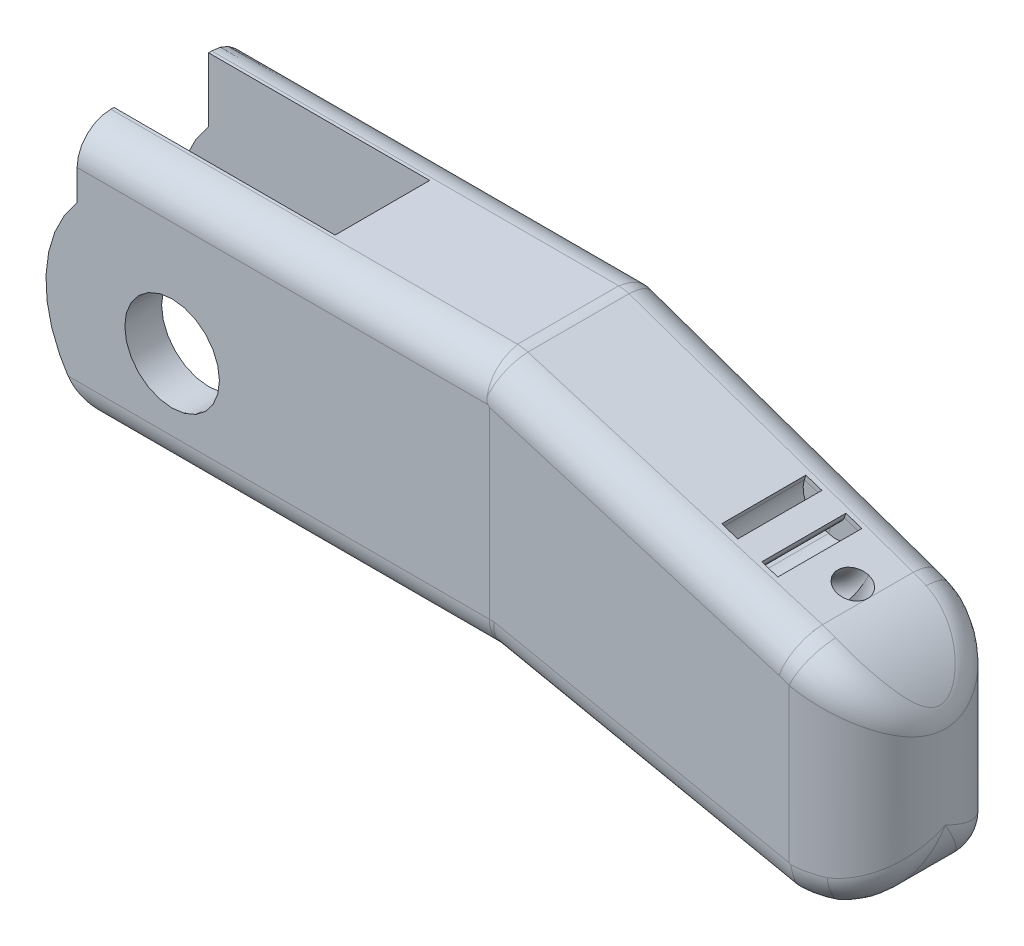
SolidWorks part; units mm, degrees
ref_plane "Front Plane" through (0, 0, 0) normal (0, 0, 1) x (1, 0, 0)
ref_plane "Top Plane" through (0, 0, 0) normal (0, 1, 0) x (1, 0, 0)
ref_plane "Right Plane" through (0, 0, 0) normal (1, 0, 0) x (0, 0, -1)
sketch "Sketch1" plane through (0, 0, 0) normal (0, 1, 0) x (1, 0, 0)
  line L0 (29.21, 12.7) -> (51.435, 12.3031)
  line L1 (0, 0) -> (29.21, 0)
  line L2 (0, 0) -> (0, 12.7)
  line L3 (0, 12.7) -> (29.21, 12.7)
  line L5 (51.435, 0.3969) -> (29.21, 0)
  arc A0 (51.435, 12.3031) -> (51.435, 0.3969) centre (51.3287, 6.35) cw
  point P9 (0, 6.35)
  dimension "D1" = 12.7
  dimension "D2" = 11.9062
  dimension "D3" = 29.21
  dimension "D4" = 22.225
extrude "Boss-Extrude1" add sketch "Sketch1" along normal blind 24.13
sketch "Sketch3" plane through (0, 0, 0) normal (0, 0, 1) x (1, 0, 0)
  line L0 (29.21, 24.13) -> (29.21, 0) construction
  line L1 (0, 0) -> (31.75, 0)
  line L2 (0, 0) -> (0, 5.08)
  line L3 (0, 5.08) -> (29.21, 5.08)
  line L5 (29.21, 5.08) -> (51.435, 0)
  line L6 (51.435, 0) -> (31.75, 0)
  dimension "D1" = 19.05
extrude "Cut-Extrude1" cut sketch "Sketch3" against normal through all
sketch "Sketch4" plane through (0, 0, 0) normal (0, 0, 1) x (1, 0, 0)
  line L0 (29.21, 24.13) -> (51.435, 16.9111)
  line L1 (51.435, 24.13) -> (51.435, 0) construction
  line L2 (57.2828, 0) -> (57.2828, 24.13) construction
  line L3 (57.2828, 11.9883) -> (57.2828, 24.13)
  line L4 (57.2828, 24.13) -> (29.21, 24.13)
  arc A0 (51.435, 16.9111) -> (57.2828, 11.9883) centre (48.2963, 7.248) cw
  dimension "D2" = 10.16
  dimension "D1" = 23.368
extrude "Cut-Extrude2" cut sketch "Sketch4" against normal through all
sketch "Sketch5" plane through (0, 0, 0) normal (0, 0, 1) x (1, 0, 0)
  line L2 (52.9648, 0) -> (57.2828, 0)
  line L3 (57.2828, 0) -> (57.2828, 5.0225)
  arc A0 (57.2828, 5.0225) -> (52.9648, 0) centre (52.2028, 5.0225) cw
  dimension "D1" = 5.08
  dimension "D2" = 4.318
extrude "Cut-Extrude3" cut sketch "Sketch5" against normal through all
sketch "Sketch7" plane through (0, 0, 0) normal (0, 0, 1) x (1, 0, 0)
  line L0 (0, 20.955) -> (0, 5.08)
  line L1 (0, 20.955) -> (0, 24.13)
  line L2 (0, 24.13) -> (29.21, 24.13) construction
  line L3 (0, 24.13) -> (-1.905, 24.13)
  line L4 (-1.905, 24.13) -> (-1.905, 19.2876)
  arc A1 (-1.905, 19.2876) -> (0, 5.08) centre (5.2651, 13.0175) ccw
  dimension "D2" = 19.05
  dimension "D1" = 3.175
  dimension "D3" = 1.905
  dimension "D4" = 4.8424
ref_plane "Plane1" through (0, 0, -6.35) normal (0, 0, 1) x (1, 0, 0)
extrude "Boss-Extrude4" add sketch "Sketch7" against normal up to surface (12.7 mm away)
sketch "Sketch9" plane through (0, 24.13, 0) normal (0, 1, 0) x (1, 0, 0)
  line L0 (-10.4775, 6.35) -> (10.4775, 6.35) construction
  line L5 (-4.2599, 2.7781) -> (14.7901, 2.7781)
  line L6 (-4.2599, 2.7781) -> (-4.2599, 9.9219)
  line L7 (-4.2599, 9.9219) -> (14.7901, 9.9219)
  line L8 (14.7901, 2.7781) -> (14.7901, 9.9219)
  line L11 (-4.2599, 12.7) -> (-4.2599, 0) construction
  point P4 (14.7901, 6.35)
  dimension "D1" = 7.1437
  dimension "D2" = 19.05
extrude "Cut-Extrude5" cut sketch "Sketch9" against normal through all
fillet "Fillet1" radius 2.54 3 edges at (40.3225, 20.5205, -12.5016) (57.2358, 12.0763, -7.0964) (40.3225, 20.5205, -0.1984)
sketch "Sketch10" plane through (0, 0, 0) normal (0, 0, 1) x (1, 0, 0)
  circle A0 centre (5.2651, 13.0175) radius 3.5719
  arc A1 (-1.905, 19.2876) -> (0, 5.08) centre (5.2651, 13.0175) ccw construction
  dimension "D1" = 7.1437
extrude "Cut-Extrude6" cut sketch "Sketch10" against normal through all
sketch "Sketch11" plane through (14.7901, 0, 0) normal (-1, 0, 0) x (0, 0, 1)
  line L0 (-6.35, -10.4775) -> (-6.35, 10.4775) construction
  line L1 (-2.7781, 24.13) -> (-9.9219, 24.13) construction
  circle A0 centre (-6.35, 22.225) radius 1.1906
  dimension "D1" = 2.3813
  dimension ".075" = 1.905
sketch "Sketch12" plane through (0, 0, -6.35) normal (0, 0, 1) x (1, 0, 0)
  line L0 (29.21, 18.2486) -> (14.7901, 21.0344)
  line L1 (51.435, 16.9111) -> (53.7298, 21.5724)
  line L2 (29.21, 21.4741) -> (29.21, 5.08) construction
  line L3 (29.21, 18.2486) -> (43.1878, 13.7084)
  line L5 (50.6957, 14.4953) -> (29.21, 21.4741) construction
  arc A0 (43.1878, 13.7084) -> (51.435, 16.9111) centre (45.3492, 20.3627) ccw
  dimension "D2" = 6.9965
  dimension "D1" = 3.0677
  dimension "D3" = 4.6613
  dimension "D4" = 2.2948
sweep "Cut-Sweep1" cut profiles "Sketch11" path "Sketch12"
sketch "Sketch13" plane through (9.8773, 30.4095, 0) normal (0.3089, 0.9511, 0) x (0.9511, -0.3089, 0)
  line L0 (20.3269, 10.1736) -> (20.3269, 2.5264) construction
  line L1 (38.6149, 9.525) -> (39.8849, 9.525)
  line L2 (38.6149, 9.525) -> (38.6149, 3.175)
  line L3 (38.6149, 3.175) -> (39.8849, 3.175)
  line L4 (39.8849, 9.525) -> (39.8849, 3.175)
  line L6 (46.1107, 6.35) -> (37.9024, 6.35) construction
  line L7 (43.6949, 6.35) -> (43.6949, 2.9233) construction
  point P6 (39.8849, 6.35)
  point P12 (20.3269, 6.35)
  point P14 (43.6949, 4.6366)
  dimension "D1" = 6.35
  dimension "D2" = 1.27
  dimension "D3" = 3.81
sketch "Sketch14" plane through (0, 0, -6.35) normal (0, 0, 1) x (1, 0, 0)
  line L1 (46.6035, 18.4804) -> (46.4858, 18.118)
  line L2 (53.7326, 16.1648) -> (45.9258, 18.7005) construction
  line L3 (45.6857, 17.7103) -> (45.0817, 17.9064)
  line L4 (44.674, 18.7065) -> (44.7917, 19.0689)
  arc A0 (46.4858, 18.118) -> (45.6857, 17.7103) centre (45.8818, 18.3142) cw
  arc A1 (45.0817, 17.9064) -> (44.674, 18.7065) centre (45.2779, 18.5104) cw
  point P9 (46.2896, 17.5141)
  point P12 (44.4778, 18.1026)
  dimension "D3" = 0.635
  dimension "D1" = 1.905
  dimension "D2" = 1.016
sweep "Cut-Sweep2" cut profiles "Sketch13" path "Sketch14"
sketch "Sketch15" plane through (14.7901, 0, 0) normal (-1, 0, 0) x (0, 0, 1)
  line L0 (-6.35, -10.4775) -> (-6.35, 10.4775) construction
  line L1 (-2.7781, 5.08) -> (-9.9219, 5.08) construction
  circle A0 centre (-6.35, 6.985) radius 1.1906
  dimension "D1" = 2.3812
  dimension "D2" = 1.905
sketch "Sketch16" plane through (0, 0, -6.35) normal (0, 0, 1) x (1, 0, 0)
  line L0 (14.7901, 8.1756) -> (19.8701, 11.5938)
  line L3 (19.8701, 11.5938) -> (29.21, 11.5938)
  line L4 (29.21, 21.4741) -> (29.21, 5.08) construction
  line L5 (29.21, 11.5938) -> (41.5907, 8.7639)
  line L6 (29.21, 5.08) -> (51.435, 0) construction
  line L7 (29.21, 5.08) -> (0, 5.08) construction
  arc A0 (41.5907, 8.7639) -> (46.3661, 1.1586) centre (40.1758, 2.5735) cw
  dimension "D1" = 5.08
  dimension "D2" = 5.0689
  dimension "D3" = 6.35
sweep "Cut-Sweep5" cut profiles "Sketch15" path "Sketch16"
sketch "Sketch17" plane through (2.5538, 11.1728, 0) normal (-0.2228, -0.9749, 0) x (0.9749, -0.2228, 0)
  line L0 (30.7439, -6.35) -> (50.1418, -6.35) construction
  line L1 (40.4898, -3.175) -> (41.7598, -3.175)
  line L2 (40.4898, -3.175) -> (40.4898, -9.525)
  line L3 (40.4898, -9.525) -> (41.7598, -9.525)
  line L4 (41.7598, -3.175) -> (41.7598, -9.525)
  line L5 (10.4775, -6.35) -> (-10.4775, -6.35) construction
  line L6 (50.1418, -12.3031) -> (50.1418, -0.3969) construction
  point P10 (40.4898, -6.35)
  dimension "D1" = 6.35
  dimension "D2" = 1.27
  dimension "D3" = 8.382
sketch "Sketch19" plane through (0, 0, -6.35) normal (0, 0, 1) x (1, 0, 0)
  line L0 (40.1686, 2.5752) -> (40.2535, 2.9466)
  line L1 (32.5247, 4.3223) -> (51.435, 0) construction
  line L2 (41.014, 3.4241) -> (41.633, 3.2827)
  line L3 (42.1106, 2.5221) -> (42.0257, 2.1507)
  arc A0 (41.633, 3.2827) -> (42.1106, 2.5221) centre (41.4915, 2.6636) cw
  arc A1 (40.2535, 2.9466) -> (41.014, 3.4241) centre (40.8725, 2.8051) cw
  point P9 (42.2521, 3.1412)
  point P12 (40.395, 3.5656)
  dimension "D3" = 0.635
  dimension "D1" = 1.016
  dimension "D2" = 1.905
sweep "Cut-Sweep6" cut profiles "Sketch17" path "Sketch19"
sketch "Sketch21" plane through (0, 5.08, 0) normal (0, -1, 0) x (1, 0, 0)
  line L1 (21.4576, -2.3812) -> (23.0451, -2.3812)
  line L2 (21.4576, -2.3812) -> (21.4576, -10.3187)
  line L3 (21.4576, -10.3187) -> (23.0451, -10.3187)
  line L4 (23.0451, -2.3812) -> (23.0451, -10.3187)
  line L5 (10.4775, -6.35) -> (-10.4775, -6.35) construction
  line L6 (14.7901, -2.7781) -> (14.7901, -9.9219) construction
  point P4 (23.0451, -6.35)
  point P9 (14.7901, -6.35)
  dimension "D1" = 7.9375
  dimension "D2" = 1.5875
  dimension "D3" = 6.6675
sketch "Sketch22" plane through (0, 0, -6.35) normal (0, 0, 1) x (1, 0, 0)
  line L0 (23.0451, 5.08) -> (25.8849, 7.62)
  line L1 (33.0812, 6.7351) -> (36.8536, 3.3329)
  line L2 (25.8849, 7.62) -> (29.21, 7.62)
  line L4 (29.21, 7.62) -> (33.0812, 6.7351)
  line L5 (29.21, 5.08) -> (51.435, 0) construction
  line L6 (29.21, 5.08) -> (0, 5.08) construction
  line L8 (29.21, 21.4741) -> (29.21, 5.08) construction
  point P2 (27.5475, 7.62)
  dimension "D4" = 3.81
  dimension "D1" = 2.54
  dimension "D2" = 2.1304
  dimension "D3" = 5.08
sweep "Cut-Sweep7" cut profiles "Sketch21" path "Sketch22"
fillet "Fillet5" radius 2.54 5 edges at (29.21, 24.13, -6.35) (27.5887, 24.13, -11.7145) (27.5887, 24.13, -0.9855) (10.7296, 24.13, 0) (10.7296, 24.13, -12.7)
fillet "Fillet6" radius 2.54 6 edges at (40.3225, 2.54, -12.5016) (52.2073, 0, -0.4611) (52.2073, 0, -12.2389) (55.819, 1.4547, -10.26) (55.819, 1.4547, -2.44) (40.3225, 2.54, -0.1984)
fillet "Fillet7" radius 2.54 4 edges at (34.9322, 5.08, -12.5978) (14.605, 5.08, -12.7) (34.9322, 5.08, -0.1022) (14.605, 5.08, 0)
sketch "Sketch23" plane through (9.8773, 30.4095, 0) normal (0.3089, 0.9511, 0) x (0.9511, -0.3089, 0)
  line L0 (-10.4775, 6.35) -> (10.4775, 6.35) construction
  line L1 (43.6949, 9.7767) -> (43.6949, 6.35) construction
  circle A0 centre (42.5043, 6.35) radius 1.1906
  dimension "D1" = 2.3812
sketch "Sketch24" plane through (0, 0, -6.35) normal (0, 0, 1) x (1, 0, 0)
  line L0 (51.435, 16.9111) -> (46.366, 1.1588)
  spline S0 degree 3 poles (46.366, 1.1586) (46.3901, 1.265) (46.4123, 1.3731) (46.5976, 2.4368) (46.5498, 3.5203) (45.8631, 5.6032) (45.2203, 6.5866) (43.5615, 8.0589) (42.5615, 8.542) (41.5907, 8.7639) knots 0.505811 0.505811 0.505811 0.505811 0.520139 0.520139 0.643686 0.643686 0.767234 0.767234 0.890781 0.890781 0.890781 0.890781 weights 0.5 0.5 0.5 0.5 0.5 0.5 0.5 0.5 0.5 0.5 construction
  dimension "D1" = 15.7523
sweep "Cut-Sweep8" cut profiles "Sketch23" path "Sketch24"
